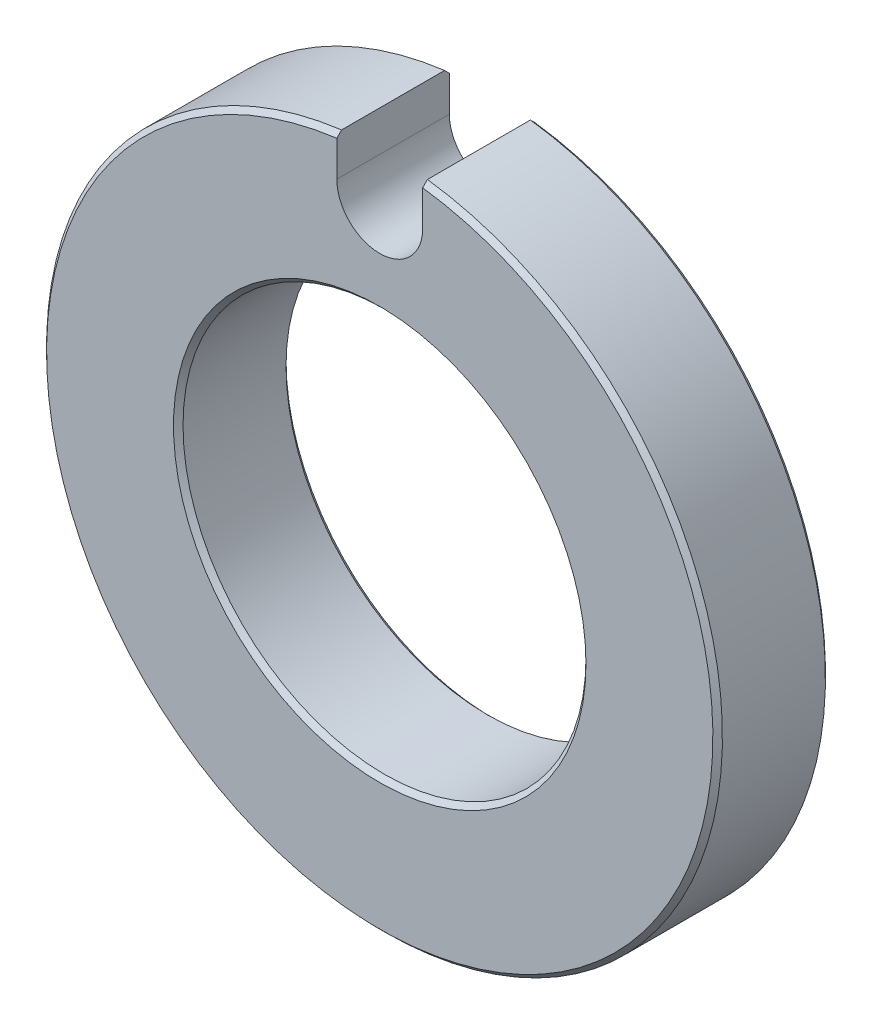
SolidWorks part; units mm, degrees
ref_plane "Front Plane" through (0, 0, 0) normal (0, 0, 1) x (1, 0, 0)
ref_plane "Top Plane" through (0, 0, 0) normal (0, 1, 0) x (1, 0, 0)
ref_plane "Right Plane" through (0, 0, 0) normal (1, 0, 0) x (0, 0, -1)
sketch "Sketch1" plane through (0, 0, 0) normal (0, 0, 1) x (1, 0, 0)
  circle A0 centre (0, 0) radius 18
  circle A1 centre (0, 0) radius 10.7315
  dimension "D1" = 21.463
  dimension "D2" = 36
extrude "Boss-Extrude1" add sketch "Sketch1" along normal blind 5.9944
chamfer "Chamfer1" distance 0.254 angle 45 4 edges at (18, 0, 0) (18, 0, 5.9944) (10.7315, 0, 0) (10.7315, 0, 5.9944)
sketch "Sketch2" plane through (0, 0, 0) normal (0, 0, 1) x (1, 0, 0)
  line L0 (-2.286, 15.7099) -> (-2.286, 19.5199)
  line L1 (-2.286, 19.5199) -> (2.286, 19.5199)
  line L2 (2.286, 19.5199) -> (2.286, 15.7099)
  arc A0 (-2.286, 15.7099) -> (2.286, 15.7099) centre (0, 15.7099) ccw
  dimension "D2" = 4.572
  dimension "D1" = 15.7099
  dimension "D3" = 3.81
extrude "Cut-Extrude1" cut sketch "Sketch2" along normal through all
